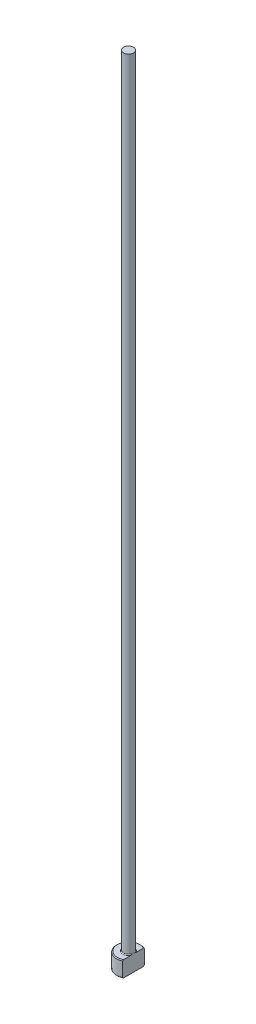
SolidWorks part; units mm, degrees
ref_plane "Front Plane" through (0, 0, 0) normal (0, 0, 1) x (1, 0, 0)
ref_plane "Top Plane" through (0, 0, 0) normal (0, 1, 0) x (1, 0, 0)
ref_plane "Right Plane" through (0, 0, 0) normal (1, 0, 0) x (0, 0, -1)
sketch "Sketch1" plane through (0, 0, 0) normal (0, 0, 1) x (1, 0, 0)
  line L0 (0, 259.9588) -> (0, -15.1925) construction
  line L1 (0, 0) -> (-3, 0)
  line L2 (-3, 0) -> (-3, 4)
  line L3 (-3, 4) -> (-1.25, 4)
  line L4 (-1.25, 4) -> (-1.25, 200)
  line L5 (-1.25, 200) -> (0, 200)
  line L6 (0, 200) -> (0, 0)
  dimension "L" = 200
  dimension "H" = 6
  dimension "T" = 4
  dimension "D" = 2.5
revolve "Revolve1" add sketch "Sketch1" angle 360 about L0
chamfer "Chamfer1" distance 0.2 angle 45 2 edges at (0, 4, 3) (0, 0, 3)
fillet "Fillet1" radius 0.2 1 edges at (0, 4, 1.25)
sketch "Sketch2" plane through (0, 0, 0) normal (0, 1, 0) x (1, 0, 0)
  line L0 (1.25, -2.7272) -> (1.25, 2.7272)
  circle A0 centre (0, 0) radius 3 construction
  arc A1 (1.25, -2.7272) -> (1.25, 2.7272) centre (0, 0) ccw
  circle A2 centre (0, 0) radius 1.25 construction
extrude "KEYED HEAD" cut sketch "Sketch2" along normal through all
